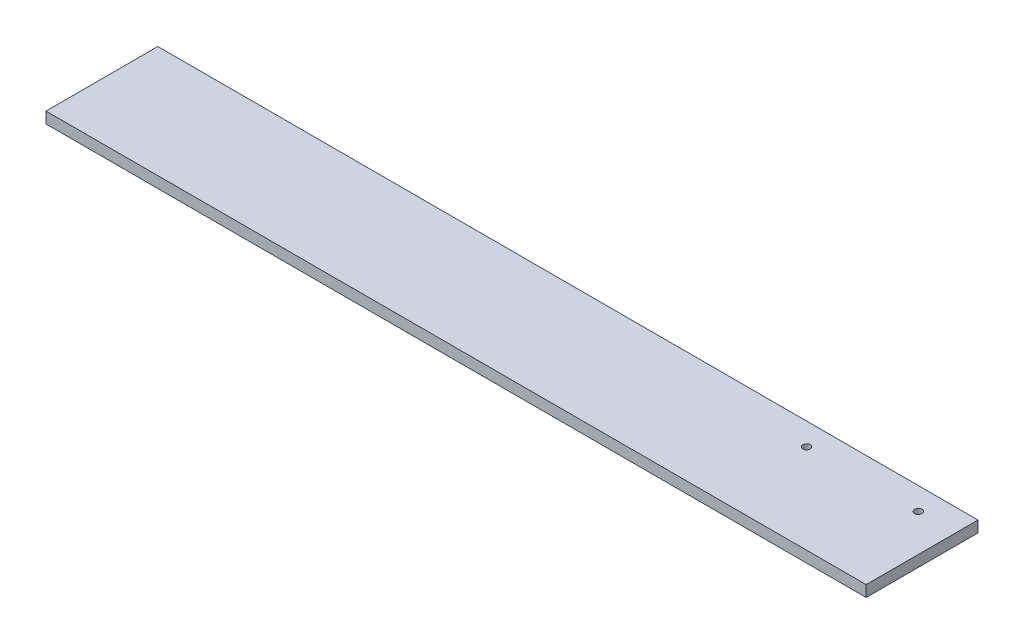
SolidWorks part; units mm, degrees
ref_plane "Front Plane" through (0, 0, 0) normal (0, 0, 1) x (1, 0, 0)
ref_plane "Top Plane" through (0, 0, 0) normal (0, 1, 0) x (1, 0, 0)
ref_plane "Right Plane" through (0, 0, 0) normal (1, 0, 0) x (0, 0, -1)
sketch "Sketch1" plane through (0, 0, 0) normal (0, 1, 0) x (1, 0, 0)
  line L1 (-110, 15) -> (110, 15)
  line L2 (-110, 15) -> (-110, -15)
  line L3 (-110, -15) -> (110, -15)
  line L4 (110, 15) -> (110, -15)
  line L5 (-110, 15) -> (110, -15) construction
  line L6 (-110, -15) -> (110, 15) construction
  point P0 (0, 0)
  dimension "D1" = 220
  dimension "D2" = 30
extrude "Boss-Extrude1" add sketch "Sketch1" along normal blind 3
sketch "Sketch2" plane through (0, 3, 0) normal (0, 1, 0) x (1, 0, 0)
  line L0 (110, 9) -> (60, 9) construction
  line L1 (110, -15) -> (110, 15) construction
  line L2 (110, 15) -> (-110, 15) construction
  circle A0 centre (100, 9) radius 1
  circle A1 centre (70, 9) radius 1
  dimension "D3" = 30
  dimension "D1" = 50
  dimension "D2" = 6
  dimension "D4" = 10
extrude "Cut-Extrude1" cut sketch "Sketch2" against normal blind 3
